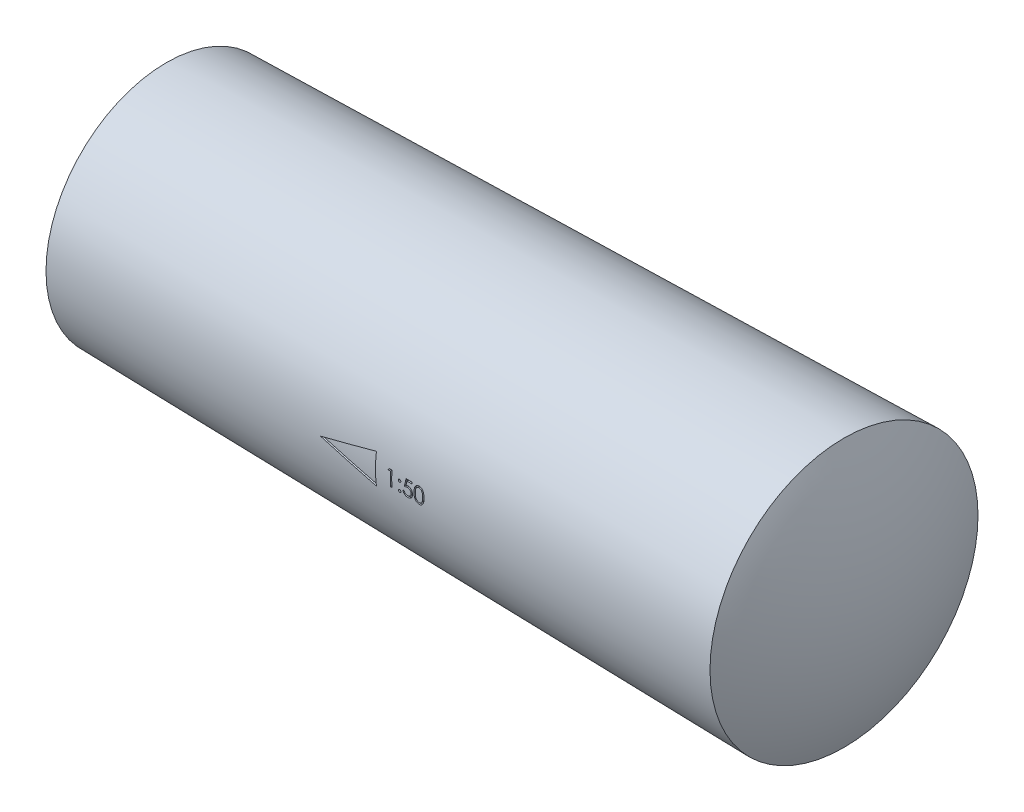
SolidWorks part; units mm, degrees
ref_plane "Front Plane" through (0, 0, 0) normal (0, 0, 1) x (1, 0, 0)
ref_plane "Top Plane" through (0, 0, 0) normal (0, 1, 0) x (1, 0, 0)
ref_plane "Right Plane" through (0, 0, 0) normal (1, 0, 0) x (0, 0, -1)
sketch "Sketch1" plane through (0, 0, 0) normal (1, 0, 0) x (0, 0, -1)
  circle A0 centre (0, 0) radius 8
  dimension "D1" = 16
extrude "Extrude1" add sketch "Sketch1" along normal mid plane 45
draft "Draft1" type of draft neutral plane draft angle 1.146 faces to draft 1 parameters "D1"=1.146
sketch "Sketch2" plane through (0, 0, 0) normal (0, 0, 1) x (1, 0, 0)
  line L0 (-22.5, 0) -> (-22.5, 8)
  line L1 (-22.5, 8) -> (-22.5, -8) construction
  line L2 (-22.5, 0) -> (-24.5, 0)
  line L3 (-24.5, 0) -> (-24.5, -8.45) construction
  line L4 (22.5, 0) -> (22.5, 8.9)
  line L5 (22.5, -8.9) -> (22.5, 8.9) construction
  line L6 (22.5, 0) -> (24.5, 0)
  line L7 (24.5, 0) -> (24.5, -8.45) construction
  line L8 (-22.5, -8) -> (22.5, -8.9) construction
  arc A0 (-24.5, 0) -> (-22.5, 8) centre (-7.5, 0) cw
  arc A1 (24.5, 0) -> (22.5, 8.9) centre (3.6974, 0) ccw
  point P14 (0, -8.45)
revolve "Revolve1" add sketch "Sketch2" angle 360 about L2
sketch "Sketch5" plane through (0, 0, 0) normal (0, 0, 1) x (1, 0, 0)
  line L0 (0, 8.45) -> (0, -8.45) construction
  line L1 (22.5, 8.9) -> (-22.5, 8) construction
  line L2 (-22.5, -8) -> (22.5, -8.9) construction
ref_plane "Plane2" through (0, 0, 0) normal (-0.02, 0, 0.9998) x (0.9998, 0, 0.02)
sketch "Sketch6" plane through (0, 0, 0) normal (-0.02, 0, 0.9998) x (0.9998, 0, 0.02)
  line L0 (0, 0) -> (0, 1)
  line L1 (0, 8.45) -> (0, -8.45) construction
  line L2 (0, 1) -> (-3.7321, 0)
  line L3 (-3.7321, 0) -> (0, -1)
  line L4 (0, -1) -> (0, 0)
  line L5 (0, -0.5) -> (4, -0.5) construction
  text T0 "1:50" font "Century Gothic" height 1
  dimension "D1" = 2
  dimension "D2" = 30
  dimension "D3" = 4
wrap "Wrap2" sketch "Sketch6" wrap type deboss source sketch "Sketch6" thickness 0.1 parameters "D1"=0.1
equation "\"D2@Sketch2\" = \"D1@Sketch2\""
